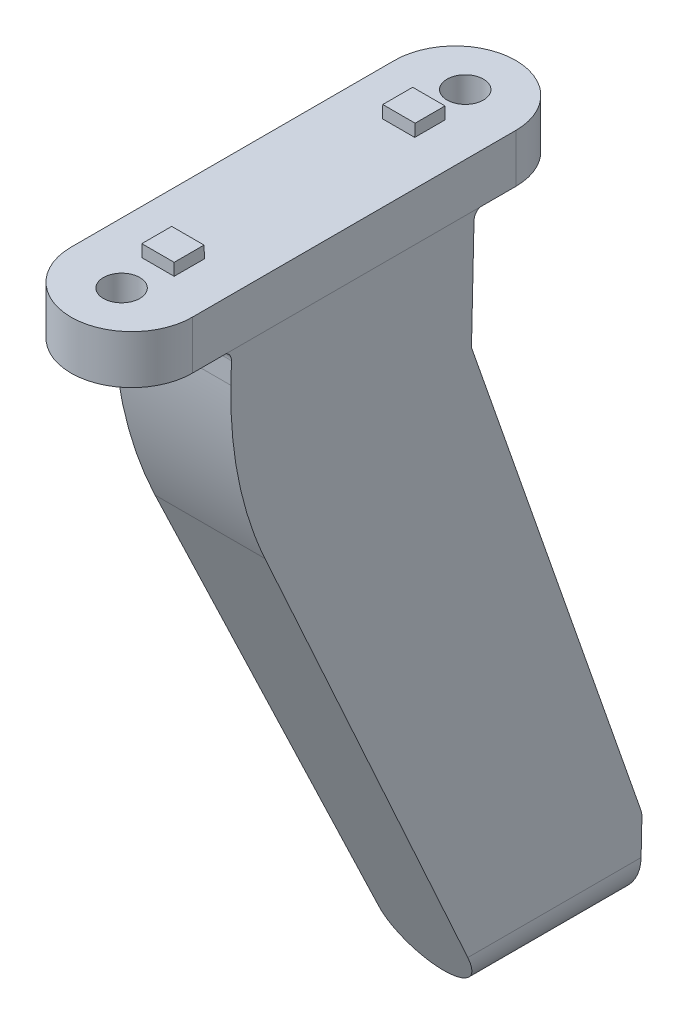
SolidWorks part; units mm, degrees
ref_plane "Front Plane" through (0, 0, 0) normal (0, 0, 1) x (1, 0, 0)
ref_plane "Top Plane" through (0, 0, 0) normal (0, 1, 0) x (1, 0, 0)
ref_plane "Right Plane" through (0, 0, 0) normal (1, 0, 0) x (0, 0, -1)
imported_body "Imported1"
ref_plane "Plane1" through (0, -175, -32.5) normal (0, 0, -1) x (-1, 0, 0)
hole_wizard "Hole1" positions "Sketch2" profile "M10x1.5 threaded hole" legacy
sketch "Sketch2" plane through (0, -175, -32.5) normal (0, 0, -1) x (-1, 0, 0)
  point P1 (0, 0)
sketch "M10x1.5 threaded hole" plane through (0, -175, -32.5) normal (1, 0, 0) x (0, 1, 0)
  line L0 (0, 0) -> (0, 30.5164)
  line L1 (0, 30.5164) -> (4.188, 28)
  line L2 (4.188, 28) -> (4.188, 0)
  line L4 (4.188, 0) -> (0, 0)
  line L6 (0, 30.5164) -> (-4.188, 28) construction
  line L7 (0, -4.2442) -> (0, 117.3081) construction
  dimension "Diameter" = 8.376
  dimension "Depth" = 28
  dimension "Drill Angle" = 118
